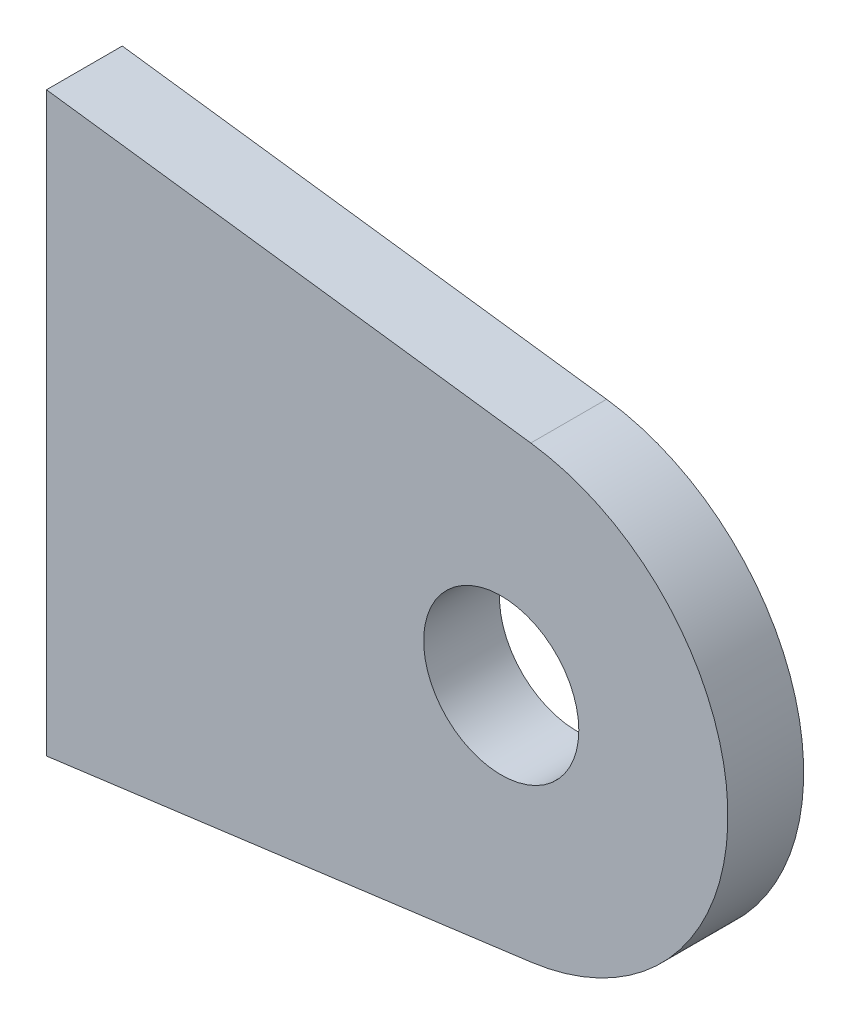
SolidWorks part; units mm, degrees
ref_plane "X-Y Datum" through (0, 0, 0) normal (0, 0, 1) x (1, 0, 0)
ref_plane "X-Z Datum" through (0, 0, 0) normal (0, 1, 0) x (1, 0, 0)
ref_plane "Y-Z Datum" through (0, 0, 0) normal (1, 0, 0) x (0, 0, -1)
sketch "Sketch1" plane through (-1053.7408, 0, 0) normal (0, 0, 1) x (1, 0, 0)
  line L0 (1054.9803, -9.4147) -> (1034.6908, -12.0859)
  line L1 (1054.9803, 9.4147) -> (1034.6908, 12.0859)
  line L2 (1034.6908, -12.0859) -> (1034.6908, 12.0859)
  circle A0 centre (1053.7408, 0) radius 3.25
  circle A1 centre (1053.7408, 0) radius 9.4959
  circle A4 centre (1053.7408, 0) radius 11.43 construction
  dimension "D3" = 18.9919
  dimension "D4" = 6.5
  dimension "D5" = 22.86
  dimension "D1" = 15
  dimension "D2" = 19.05
extrude "Boss-Extrude1" add sketch "Sketch1" along normal blind 3.175
